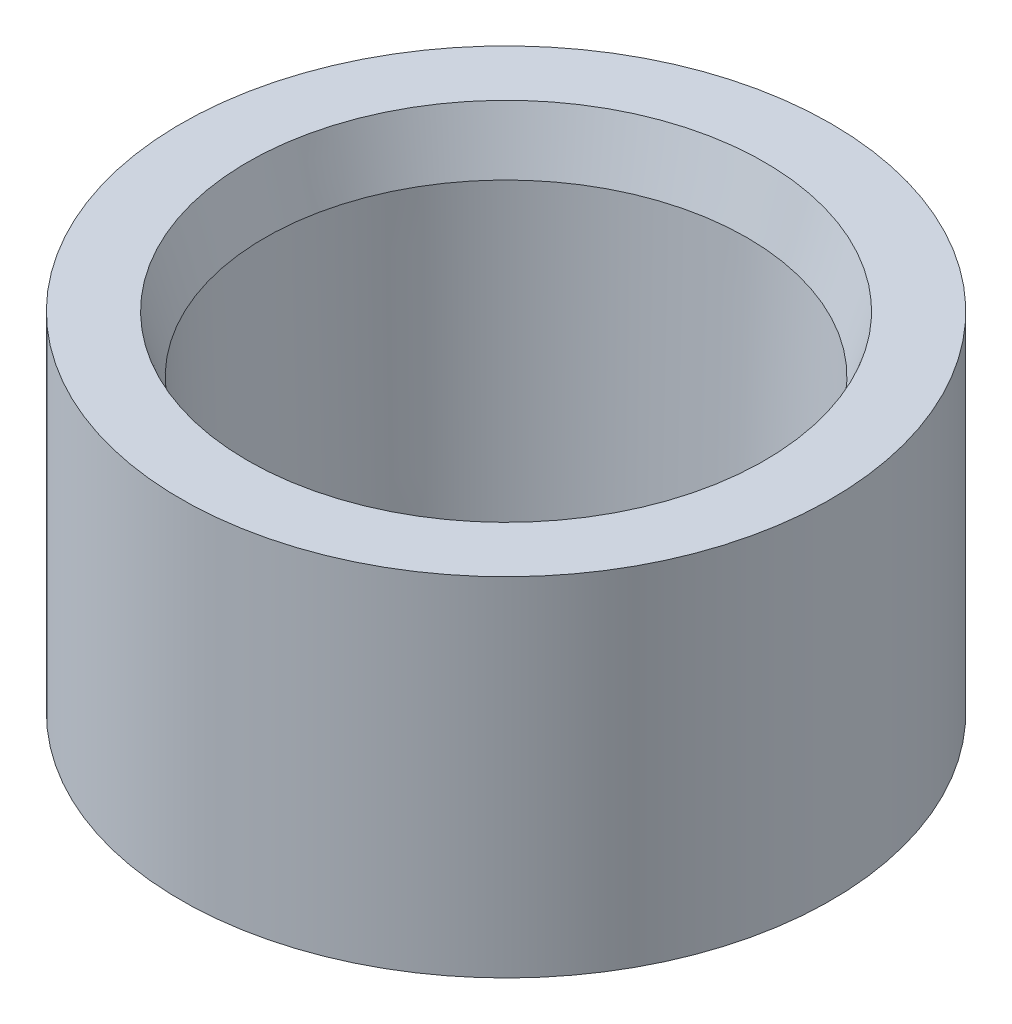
SolidWorks part; units mm, degrees
ref_plane "Front Plane" through (0, 0, 0) normal (0, 0, 1) x (1, 0, 0)
ref_plane "Top Plane" through (0, 0, 0) normal (0, 1, 0) x (1, 0, 0)
ref_plane "Right Plane" through (0, 0, 0) normal (1, 0, 0) x (0, 0, -1)
sketch "Sketch1" plane through (0, 0, 0) normal (0, 0, 1) x (1, 0, 0)
  line L0 (0, 0) -> (0, 70) construction
  line L1 (46.4312, 0) -> (48.9712, 70)
  line L2 (48.9712, 70) -> (65.4812, 70)
  line L3 (65.4812, 70) -> (65.4812, 0)
  line L4 (65.4812, 0) -> (46.4312, 0)
  dimension "D1" = 70
  dimension "D2" = 92.8624
  dimension "D3" = 2.54
  dimension "D4" = 19.05
revolve "Revolve1" add sketch "Sketch1" angle 360 about L0
chamfer "Chamfer1" distance 11.43 angle 15 1 edges at (0, 70, -48.9712)
